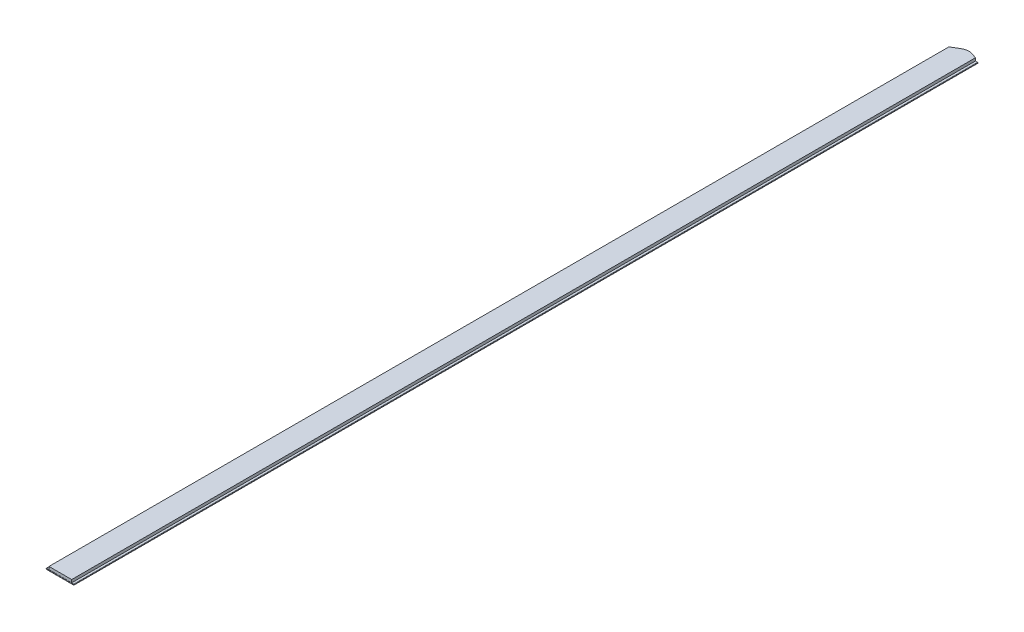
SolidWorks part; units mm, degrees
ref_plane "Front Plane" through (0, 0, 0) normal (0, 0, 1) x (1, 0, 0)
ref_plane "Top Plane" through (0, 0, 0) normal (0, 1, 0) x (1, 0, 0)
ref_plane "Right Plane" through (0, 0, 0) normal (1, 0, 0) x (0, 0, -1)
sketch "Sketch1" plane through (0, 0, 0) normal (0, 0, 1) x (1, 0, 0)
  line L0 (9, 0.3) -> (9.9, 0.3)
  line L1 (0, 0) -> (9.9, 0)
  line L2 (0, 0) -> (0, 0.3)
  line L3 (0, 0.3) -> (1, 0.3)
  line L4 (9.9, 0) -> (9.9, 0.3)
  line L6 (1, 0.3) -> (1, 1.3)
  line L7 (1, 1.3) -> (9, 1.3)
  line L8 (9, 0.3) -> (9, 1.3)
  dimension "D1" = 9.9
  dimension "D2" = 1
  dimension "D3" = 8
  dimension "D4" = 0.3
  dimension "D5" = 1
extrude "Extrude1" add sketch "Sketch1" against normal blind 320
sketch "Sketch3" plane through (0, 1.3, 0) normal (0, 1, 0) x (1, 0, 0)
  spline S0 degree 3 poles (-6.1874, 322.9771) (-1.1149, 313.5261) (4.443, 320.9779) (10.1435, 317.3739) (15.6516, 321.8981) (17.0533, 332.1639) (10.7825, 332.171) (1.1392, 332.451) (-5.9828, 332.8836) (-6.1874, 322.9771) (-1.1149, 313.5261) (4.443, 320.9779) knots -0.333493 -0.218422 -0.091869 0 0.140766 0.20548 0.31134 0.45536 0.633885 0.666507 0.781578 0.908131 1 1.140766 1.20548 1.31134 only from (-1.6397, 316.6765) to (-1.6397, 316.6765)
extrude "Extrude2" cut sketch "Sketch3" against normal blind 2
sketch "Sketch4" plane through (0, 0, 0) normal (0, 0, 1) x (1, 0, 0)
  line L0 (1, 0.3) -> (0, 0.3) construction
  line L1 (0.6487, 0.3) -> (9.5222, 0.3)
  line L2 (0.6487, 0.3) -> (0.6487, 1.6684)
  line L3 (0.6487, 1.6684) -> (9.5222, 1.6684)
  line L4 (9.5222, 0.3) -> (9.5222, 1.6684)
extrude "Extrude3" cut sketch "Sketch4" against normal blind 0.05
fillet "Fillet1" radius 0.15 4 edges at (9.9, 0, -159.2398) (9.9, 0.3, -159.2398) (0, 0, -158.3505) (0, 0.3, -158.3505)
